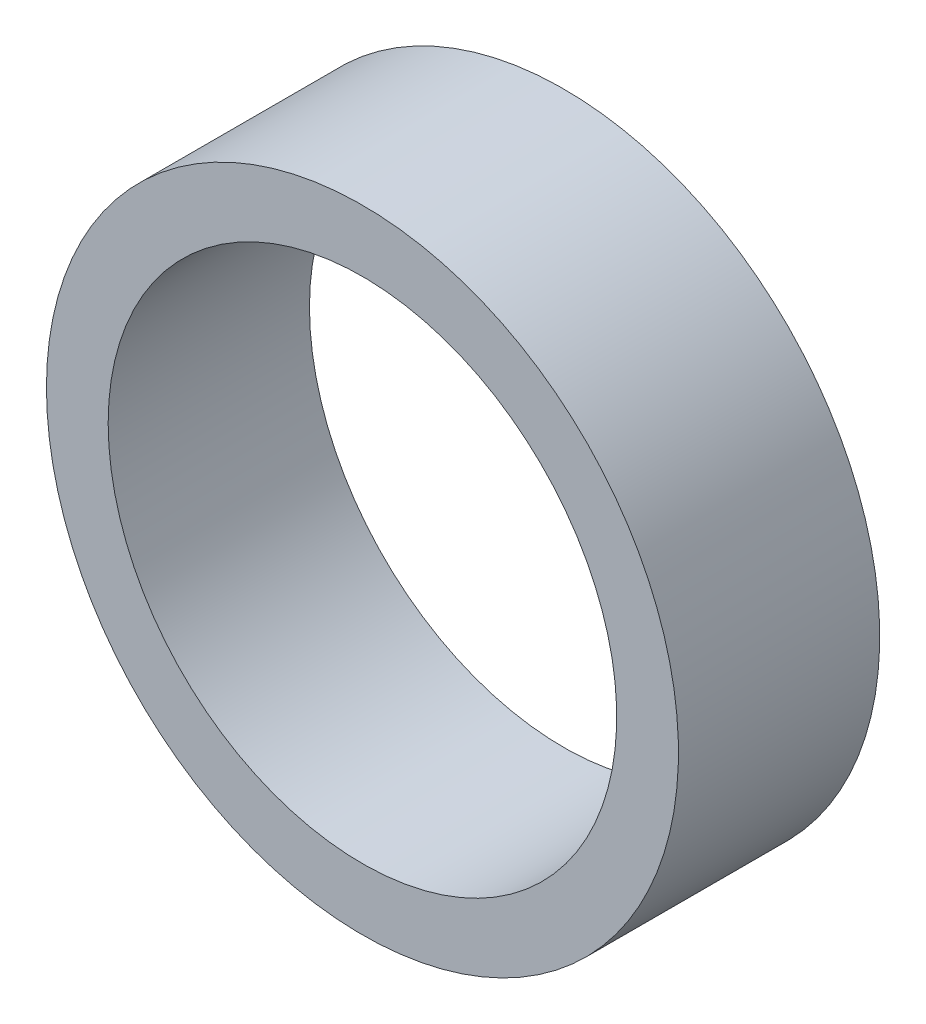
SolidWorks part; units mm, degrees
ref_plane "Front Plane" through (0, 0, 0) normal (0, 0, 1) x (1, 0, 0)
ref_plane "Top Plane" through (0, 0, 0) normal (0, 1, 0) x (1, 0, 0)
ref_plane "Right Plane" through (0, 0, 0) normal (1, 0, 0) x (0, 0, -1)
sketch "Sketch1" plane through (0, 0, 0) normal (0, 0, 1) x (1, 0, 0)
  circle A0 centre (0, 0) radius 5.9817
  circle A1 centre (0, 0) radius 4.8133
  dimension "D1" = 11.9634
  dimension "ID" = 9.6266
extrude "Extrude1" add sketch "Sketch1" along normal mid plane 3.81
sketch "Sketch2" plane through (0, 0, 0) normal (1, 0, 0) x (0, 0, -1)
  line L0 (-1.905, -4.8133) -> (1.905, -4.8133) construction
  line L3 (1.905, 4.8133) -> (-1.905, 4.8133) construction
  line L5 (-1.905, -4.8133) -> (1.905, -4.8133)
  line L6 (1.905, 4.8133) -> (-1.905, 4.8133)
sketch "Sketch4" plane through (0, 0, 1.905) normal (0, 0, 1) x (1, 0, 0)
  line L0 (0, 0) -> (-3.4035, 3.4035)
  line L1 (0, -6.5799) -> (0, 6.5799) construction
  circle A0 centre (0, 0) radius 4.8133 construction
  dimension "D1" = 45
